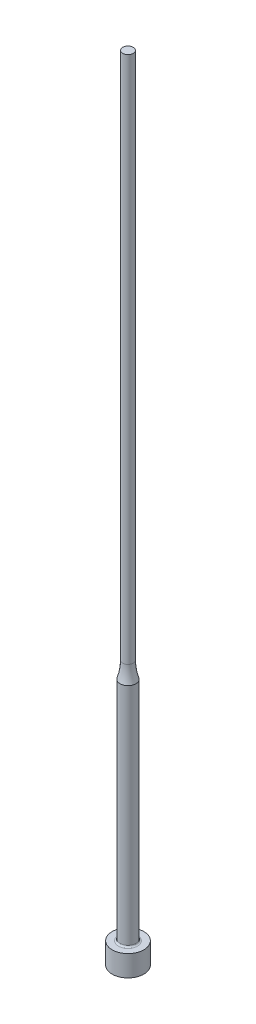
SolidWorks part; units mm, degrees
ref_plane "Front Plane" through (0, 0, 0) normal (0, 0, 1) x (1, 0, 0)
ref_plane "Top Plane" through (0, 0, 0) normal (0, 1, 0) x (1, 0, 0)
ref_plane "Right Plane" through (0, 0, 0) normal (1, 0, 0) x (0, 0, -1)
sketch "Sketch1" plane through (0, 0, 0) normal (0, 0, 1) x (1, 0, 0)
  line L0 (0, 0) -> (3, 0)
  line L1 (55, 0) -> (-55, 0) construction
  line L2 (3, 0) -> (3, 4)
  line L3 (3, 4) -> (1.8, 4)
  line L4 (1.5, 4.3) -> (1.5, 46.8775)
  line L6 (1, 50) -> (1, 150)
  line L7 (1, 150) -> (0, 150)
  line L8 (0, 150) -> (0, 0)
  arc A0 (1, 50) -> (1.5, 46.8775) centre (11, 50) ccw
  arc A1 (1.8, 4) -> (1.5, 4.3) centre (1.8, 4.3) cw
  dimension "D7" = 50
  dimension "D8" = 0.3
  dimension "D5" = 10
  dimension "D1" = 1
  dimension "D2" = 1.5
  dimension "D3" = 3
  dimension "D4" = 4
  dimension "D6" = 150
revolve "Revolve1" add sketch "Sketch1" angle 360 about L8
